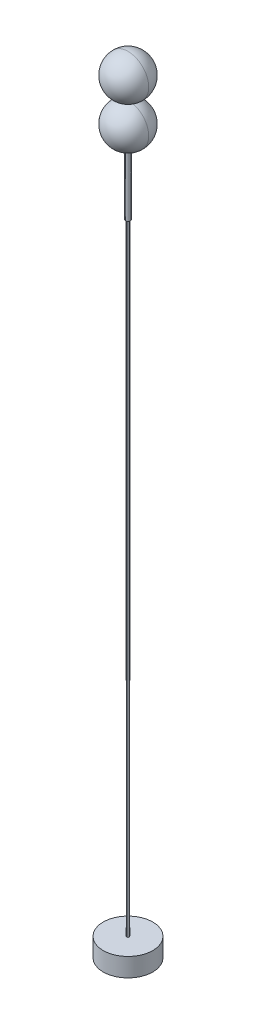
SolidWorks part; units mm, degrees
ref_plane "Alzado" through (0, 0, 0) normal (0, 0, 1) x (1, 0, 0)
ref_plane "Planta" through (0, 0, 0) normal (0, 1, 0) x (1, 0, 0)
ref_plane "Vista lateral" through (0, 0, 0) normal (1, 0, 0) x (0, 0, -1)
imported_body "C1280.IGS<1>"
delete or keep bodies "Sólido-Eliminar/Conservar 1" type delete bodies bodies 104
ref_plane "Plano1" through (0, -1700, 0) normal (0, 1, 0) x (1, 0, 0)
sketch "Croquis2" plane through (0, -1700, 0) normal (0, 1, 0) x (1, 0, 0)
  circle A0 centre (0, 0) radius 59.944
  dimension "D1" = 119.888
extrude "Saliente-Extruir1" add sketch "Croquis2" against normal blind 44.958
